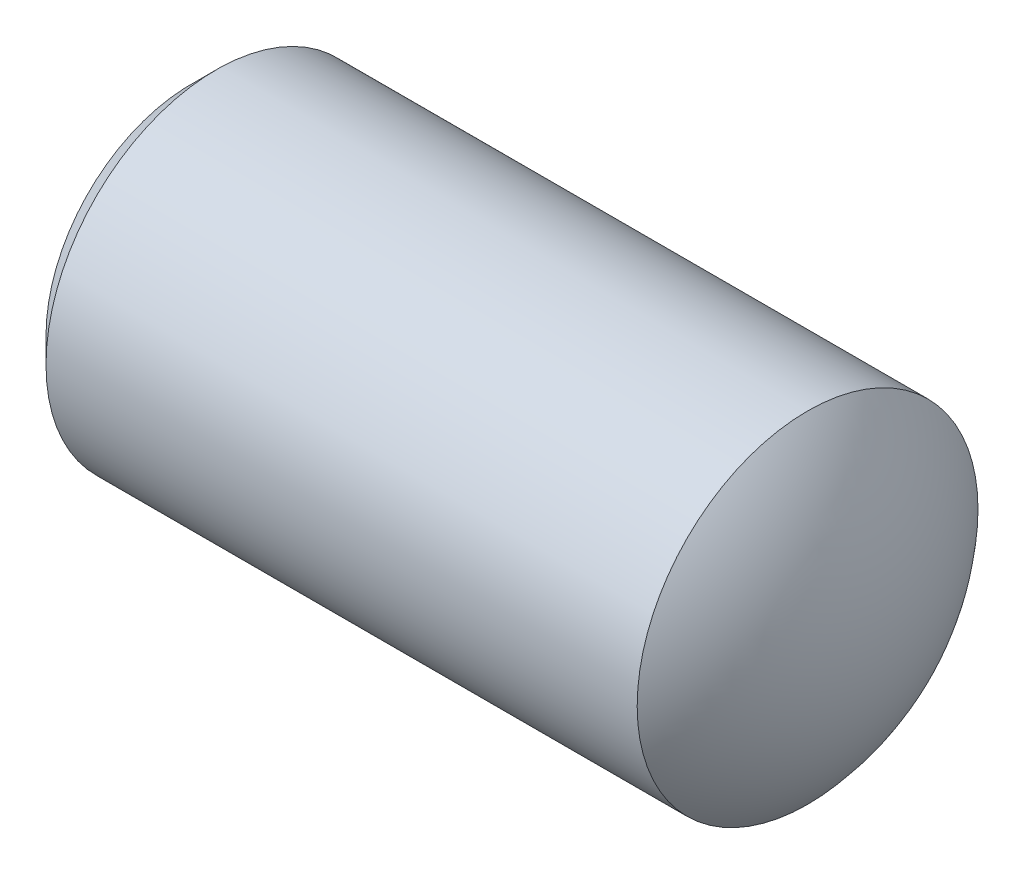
SolidWorks part; units mm, degrees
ref_plane "Plane1" through (0, 0, 0) normal (0, 0, 1) x (1, 0, 0)
ref_plane "Plane2" through (0, 0, 0) normal (0, 1, 0) x (1, 0, 0)
ref_plane "Plane3" through (0, 0, 0) normal (1, 0, 0) x (0, 0, -1)
sketch "BodySke" plane through (0, 0, 0) normal (0, 0, 1) x (1, 0, 0)
  line L0 (0, 0) -> (0, 10.8102)
  line L1 (0, 10.8102) -> (1.8898, 12.7)
  line L2 (1.8898, 12.7) -> (45.949, 12.7)
  line L3 (2.1082, 15.875) -> (2.1082, -3.175) construction
  line L4 (50.8, 0) -> (0, 0)
  line L5 (-12.7, 0) -> (88.9, 0) construction
  line L8 (0, -10.8102) -> (1.8898, -12.7) construction
  arc A0 (50.8, 0) -> (45.949, 12.7) centre (31.75, 0) ccw
  dimension "Oval_radius" = 19.05
  dimension "Length" = 50.8
  dimension "Diameter" = 25.4
  dimension "Drive_ch_ang" = 45
  dimension "Minor_dia" = 21.6205
  dimension "Advance" = 2.1082
revolve "BaseBody" add sketch "BodySke" angle 360 about L5
sketch "Sketch2" plane through (0, 0, 0) normal (-1, 0, 0) x (0, 0, 1)
  line L0 (4.1208, 7.1374) -> (-4.1208, 7.1374)
  line L1 (-4.1208, 7.1374) -> (-8.2416, 0)
  line L2 (4.1208, 7.1374) -> (8.2416, 0)
  line L3 (4.1208, -7.1374) -> (8.2416, 0)
  line L4 (4.1208, -7.1374) -> (-4.1208, -7.1374)
  line L5 (-4.1208, -7.1374) -> (-8.2416, 0)
  dimension "Hex_size" = 14.2748
  dimension "D2" = 7.1374
  dimension "D3" = 7.1374
extrude "Hex" cut sketch "Sketch2" against normal blind 14.2748
sketch "Sketch4" plane through (0, 4.7709, -0.5249) normal (-1, 0, 0) x (0, 0, 1)
  line L0 (0.5249, -4.7709) -> (10.6976, -4.7709)
  line L1 (0.5249, -4.7709) -> (6.6732, -1.2211) construction
  line L2 (0.5249, -4.7709) -> (5.6112, 4.0389)
  line L3 (8.9666, -2.6687) -> (10.2861, -1.9069)
  line L4 (6.5663, 1.4888) -> (7.8858, 2.2506)
  arc A0 (8.9666, -2.6687) -> (6.5663, 1.4888) centre (0.5249, -4.7709) ccw
  arc A1 (10.6976, -4.7709) -> (10.2861, -1.9069) centre (0.5249, -4.7709) ccw
  arc A2 (5.6112, 4.0389) -> (7.8858, 2.2506) centre (0.5249, -4.7709) cw
  circle A3 centre (0.5249, -4.7709) radius 8.6995 construction
  circle A4 centre (0.5249, -4.7709) radius 10.1727 construction
  dimension "D1" = 30
  dimension "Spline_n_dim" = 17.399
  dimension "Spline_m_dim" = 20.3454
  dimension "Spline_a_dim" = 60
  dimension "D3" = 2.4003
  dimension "Spline_p_dim" = 4.8006
extrude "Spline" [suppressed] cut sketch "Sketch4" against normal blind 12.7
pattern_circular "CirPattern1" [suppressed] count 6 every 60 about axis through (-12.7, 0, 0) along (1, 0, 0)
sketch "ThdSchSke" plane through (0, 0, 0) normal (0, 0, 1) x (1, 0, 0)
  line L0 (1.8898, -10.8102) -> (0.5665, -12.7)
  line L1 (1.8898, -10.8102) -> (3.213, -12.7)
  line L2 (3.213, -12.7) -> (3.213, -15.875)
  line L3 (-3.175, 0) -> (5.1513, 0) construction
  line L4 (1.8898, 12.7) -> (1.8898, -12.7) construction
  line L5 (3.213, -15.875) -> (0.5665, -15.875)
  line L6 (0.5665, -15.875) -> (0.5665, -12.7)
  dimension "Thread_minor" = 21.6205
  dimension "Diameter" = 25.4
  dimension "SideAngle" = 55
  dimension "VeeAngle" = 70
  dimension "Overcut" = 31.75
revolve "ThreadSchematic" [suppressed] cut sketch "ThdSchSke" angle 360 about L3
pattern_linear "ThdSchPat" [suppressed]
equation "\"D2@Sketch2\" = \"Hex_size@Sketch2\" / 2"
equation "\"D3@Sketch2\" = \"Hex_size@Sketch2\" / 2"
equation "\"Thread_minor@ThreadCosmetic\" = \"Minor_dia@BodySke\""
equation "\"D1@Sketch4\" = \"Spline_a_dim@Sketch4\" / 2"
equation "\"D3@Sketch4\" = \"Spline_p_dim@Sketch4\" / 2"
equation "\"D2@CirPattern1\" = \"Spline_a_dim@Sketch4\""
equation "\"Num_teeth@CirPattern1\" = 360 / \"D2@CirPattern1\""
equation "\"Thread_minor@ThdSchSke\" = \"Thread_minor@ThreadCosmetic\""
equation "\"Diameter@ThdSchSke\" = \"Diameter@BodySke\""
equation "\"Overcut@ThdSchSke\" = \"Diameter@BodySke\" * 1.25"
equation "\"Num_threads@ThdSchPat\" = int( (\"Length@BodySke\" - ( ( ( \"Diameter@BodySke\" - \"Minor_dia@BodySke\" ) * 0.5 ) / tan( \"Drive_ch_ang@BodySke\" * 0.017453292 ) ) - ( \"Oval_radius@BodySke\" - sqr ( ( \"Oval_ra"
equation "\"Advance@ThdSchPat\" = (\"Length@BodySke\" - ( ( ( \"Diameter@BodySke\" - \"Minor_dia@BodySke\" ) * 0.5 ) / tan( \"Drive_ch_ang@BodySke\" * 0.017453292 ) ) - ( \"Oval_radius@BodySke\" - sqr ( ( \"Oval_radius@Body"
equation "' \"Num_threads@ThdSchPat\" = \"Num_threads@ThdSchPat\" - sgn( \"Num_threads@ThdSchPat\" - 1) '---chamfered tips only---"
